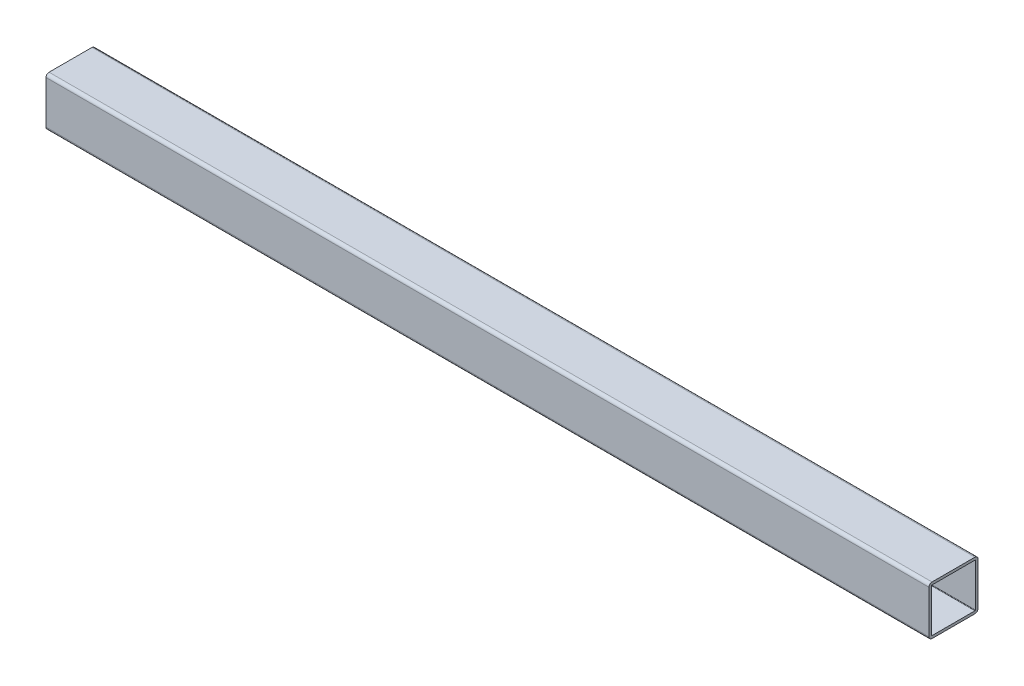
SolidWorks part; units mm, degrees
ref_plane "Front Plane" through (0, 0, 0) normal (0, 0, 1) x (1, 0, 0)
ref_plane "Top Plane" through (0, 0, 0) normal (0, 1, 0) x (1, 0, 0)
ref_plane "Right Plane" through (0, 0, 0) normal (1, 0, 0) x (0, 0, -1)
sketch "Sketch1" plane through (0, 0, 0) normal (1, 0, 0) x (0, 0, -1)
  line L0 (-5.373, 3.898) -> (16.852, 3.898)
  line L1 (-5.373, 5.2442) -> (16.852, 5.2442)
  line L2 (-6.9605, 3.6567) -> (-6.9605, -18.5683)
  line L3 (-5.373, -20.1558) -> (16.852, -20.1558)
  line L4 (18.4395, 3.6567) -> (18.4395, -18.5683)
  line L5 (17.0933, 3.6567) -> (17.0933, -18.5683)
  line L6 (-5.373, -18.8096) -> (16.852, -18.8096)
  line L7 (-5.6143, 3.6567) -> (-5.6143, -18.5683)
  arc A0 (16.852, 5.2442) -> (18.4395, 3.6567) centre (16.852, 3.6567) cw
  arc A1 (-6.9605, 3.6567) -> (-5.373, 5.2442) centre (-5.373, 3.6567) cw
  arc A2 (-5.373, -20.1558) -> (-6.9605, -18.5683) centre (-5.373, -18.5683) cw
  arc A3 (18.4395, -18.5683) -> (16.852, -20.1558) centre (16.852, -18.5683) cw
  arc A4 (16.852, 3.898) -> (17.0933, 3.6567) centre (16.852, 3.6567) cw
  arc A5 (17.0933, -18.5683) -> (16.852, -18.8096) centre (16.852, -18.5683) cw
  arc A6 (-5.373, -18.8096) -> (-5.6143, -18.5683) centre (-5.373, -18.5683) cw
  arc A7 (-5.6143, 3.6567) -> (-5.373, 3.898) centre (-5.373, 3.6567) cw
  point P6 (18.4395, 5.2442)
  point P9 (-6.9605, 5.2442)
  point P14 (18.4395, -20.1558)
  dimension "D3" = 1.5875
  dimension "D1" = 25.4
  dimension "D2" = 25.4
  dimension "D4" = 1.3462
extrude "Extrude1" add sketch "Sketch1" along normal blind 457.2
